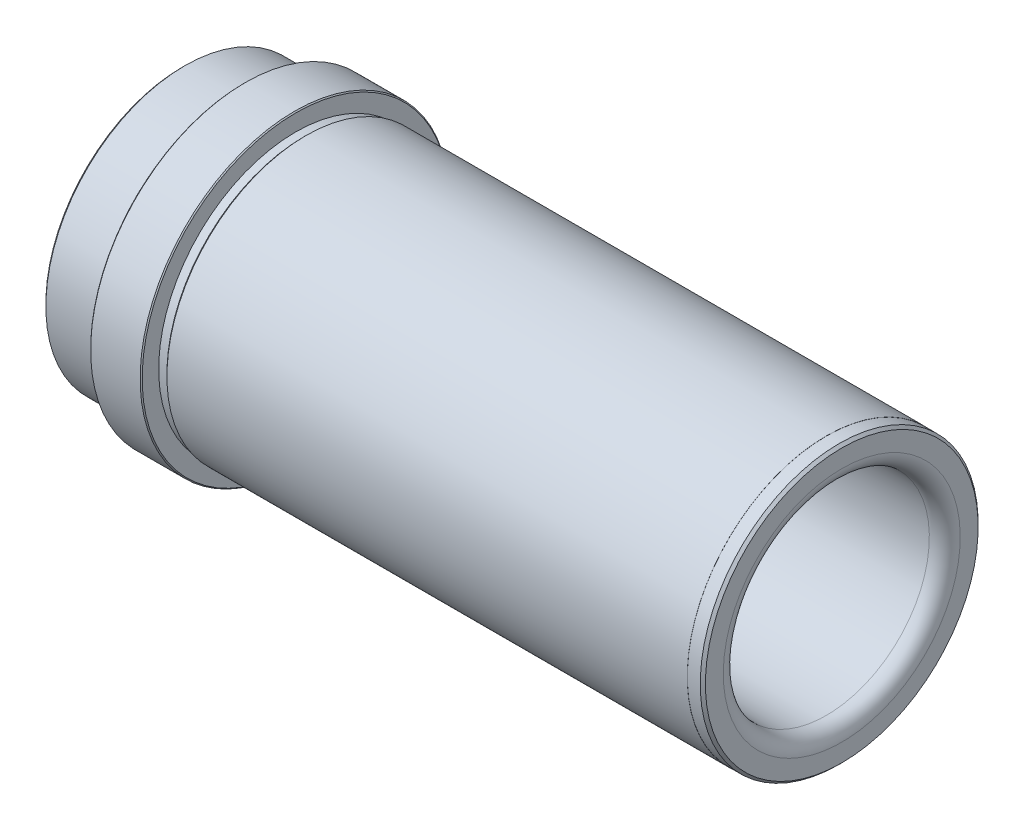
SolidWorks part; units mm, degrees
ref_plane "Front Plane" through (0, 0, 0) normal (0, 0, 1) x (1, 0, 0)
ref_plane "Top Plane" through (0, 0, 0) normal (0, 1, 0) x (1, 0, 0)
ref_plane "Right Plane" through (0, 0, 0) normal (1, 0, 0) x (0, 0, -1)
sketch "Sketch1" plane through (0, 0, 0) normal (0, 0, 1) x (1, 0, 0)
  line L0 (-47, 30) -> (-47, 26.6) construction
  line L1 (61, 27) -> (-40, 27)
  line L2 (-52, 26.6) -> (-53.6, 26.6)
  line L3 (-53.6, 26.6) -> (-54, 27)
  line L4 (64, 26.975) -> (61, 26.975)
  line L5 (61, 26.975) -> (61, 27)
  line L6 (-42, 30) -> (-42, 26.6)
  line L7 (-42, 30) -> (-52, 30)
  line L8 (-52, 26.6) -> (-52, 30)
  line L11 (-54, 27) -> (-64, 27)
  line L12 (-64, 27) -> (-64, 0)
  line L13 (64, 26.975) -> (64, 0)
  line L14 (64, 0) -> (-64, 0) construction
  line L15 (64, 0) -> (-64, 0)
  line L16 (-40, 27) -> (-40.4, 26.6)
  line L17 (-40.4, 26.6) -> (-42, 26.6)
  point P0 (0, 0)
  point P16 (0, 0)
  dimension "D5" = 2
  dimension "D1" = 135
  dimension "D2" = 135
  dimension "PinDia" = 54
  dimension "D3" = 0.4
  dimension "D4" = 2
  dimension "T" = 10
  dimension "CollarLength" = 12
  dimension "HeadDia" = 60
  dimension "D6" = 0.025
  dimension "S" = 116
  dimension "LeadLength" = 3
revolve "Revolve1" add sketch "Sketch1" angle 360 about L14
sketch "Sketch2" plane through (64, 0, 0) normal (1, 0, 0) x (0, 0, -1)
  circle A0 centre (0, 0) radius 20
  circle A1 centre (0, 0) radius 27 construction
  dimension "ID" = 40
extrude "Extrude1" cut sketch "Sketch2" against normal blind 116
sketch "Sketch3" plane through (-52, 0, 0) normal (1, 0, 0) x (0, 0, -1)
  circle A2 centre (0, 0) radius 20.01
  circle A3 centre (0, 0) radius 20.01
  dimension "D1" = 0.01
extrude "Extrude2" cut sketch "Sketch3" against normal through all
fillet "Fillet2" radius 3 1 edges at (64, 20, 0)
chamfer "Chamfer3" distance 0.5 angle 45 1 edges at (64, 26.975, 0)
chamfer "Chamfer4" distance 0.2 angle 45 2 edges at (-52, 30, 0) (-42, 30, 0)
chamfer "Chamfer5" [suppressed] distance 0.5 angle 45
chamfer "Chamfer6" distance 0.5 angle 45 2 edges at (-64, 20.01, 0) (-64, 27, 0)
